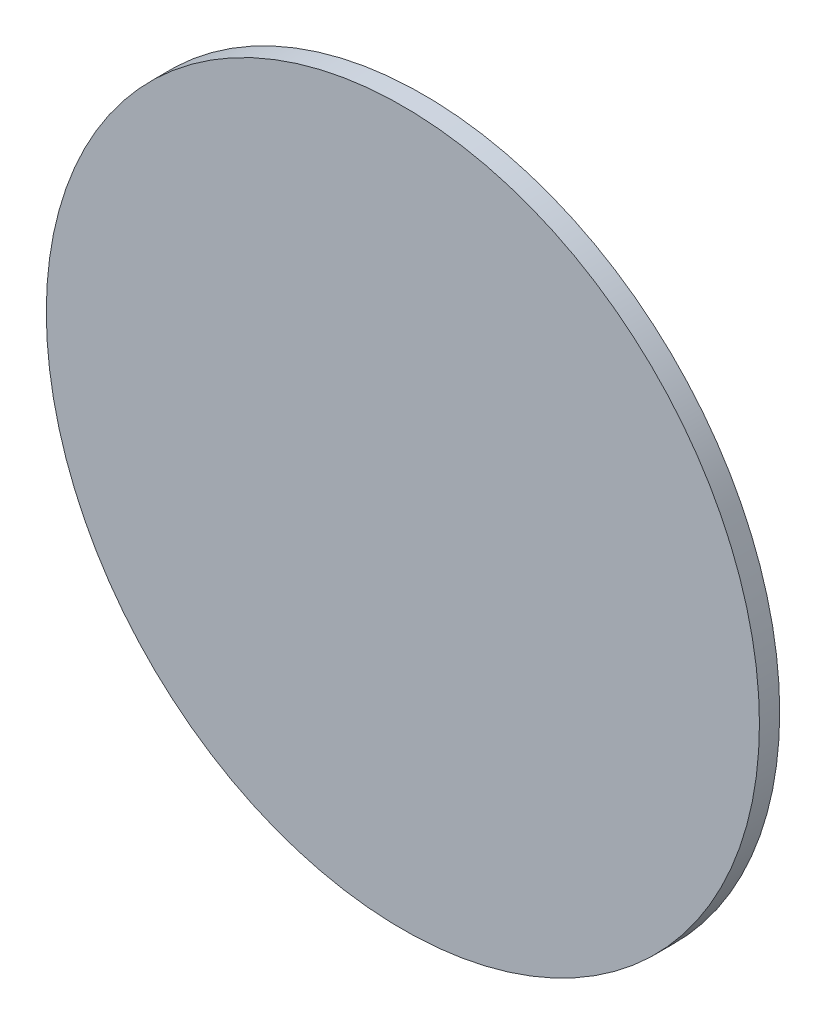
SolidWorks part; units mm, degrees
ref_plane "Alzado" through (0, 0, 0) normal (0, 0, 1) x (1, 0, 0)
ref_plane "Planta" through (0, 0, 0) normal (0, 1, 0) x (1, 0, 0)
ref_plane "Vista lateral" through (0, 0, 0) normal (1, 0, 0) x (0, 0, -1)
sketch "Croquis1" plane through (0, 0, 0) normal (0, 0, 1) x (1, 0, 0)
  circle A0 centre (0, 0) radius 88
extrude "Saliente-Extruir1" add sketch "Croquis1" along normal blind 5
